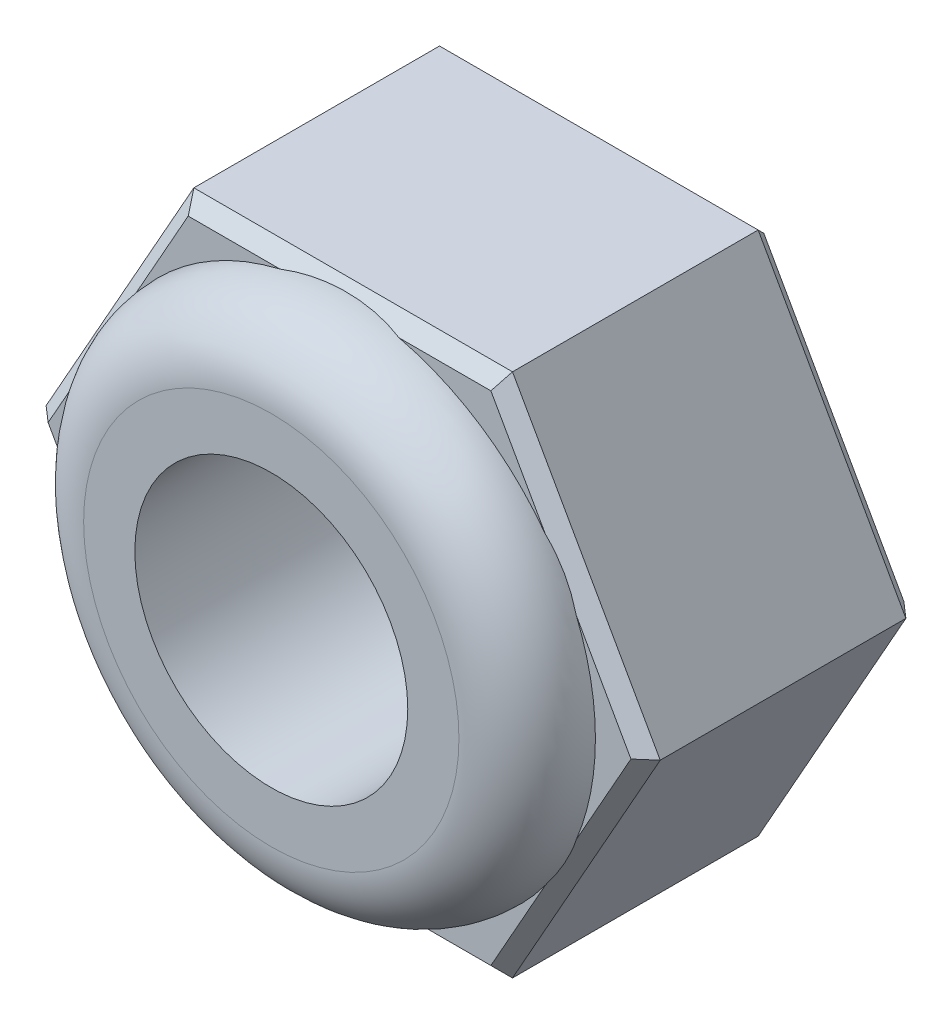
SolidWorks part; units mm, degrees
ref_plane "Plane1" through (0, 0, 0) normal (0, 0, 1) x (1, 0, 0)
ref_plane "Plane2" through (0, 0, 0) normal (0, 1, 0) x (1, 0, 0)
ref_plane "Plane3" through (0, 0, 0) normal (1, 0, 0) x (0, 0, -1)
sketch "Esquisse1" plane through (0, 0, 0) normal (0, 0, 1) x (1, 0, 0)
  line L0 (-2.3348, 3.8469) -> (2.3348, 3.8469)
  line L1 (2.3348, 3.8469) -> (4.5, 0)
  line L2 (-4.5, 0) -> (-2.3348, -3.8469)
  line L3 (-4.5, 0) -> (-2.3348, 3.8469)
  line L4 (-2.3348, -3.8469) -> (2.3348, -3.8469)
  line L5 (2.3348, -3.8469) -> (4.5, 0)
extrude "Base-Extrusion" add sketch "Esquisse1" along normal blind 4
sketch "Esquisse2" plane through (0, 0, 4) normal (0, 0, 1) x (1, 0, 0)
  circle A0 centre (0, 0) radius 3.75
  dimension "D1" = 7.5
extrude "Boss.-Extru.1" add sketch "Esquisse2" along normal blind 1
sketch "Esquisse3" plane through (0, 0, 5) normal (0, 0, 1) x (1, 0, 0)
  circle A0 centre (0, 0) radius 2
  dimension "D1" = 4
extrude "Enlèv. mat.-Extru.1" cut sketch "Esquisse3" against normal blind 11
fillet "Congé2" radius 1
chamfer "Chanfrein1" distance 0.2 angle 45
chamfer "Chanfrein2" distance 0.2 angle 45
chamfer "Chanfrein3" distance 0.2 angle 45
